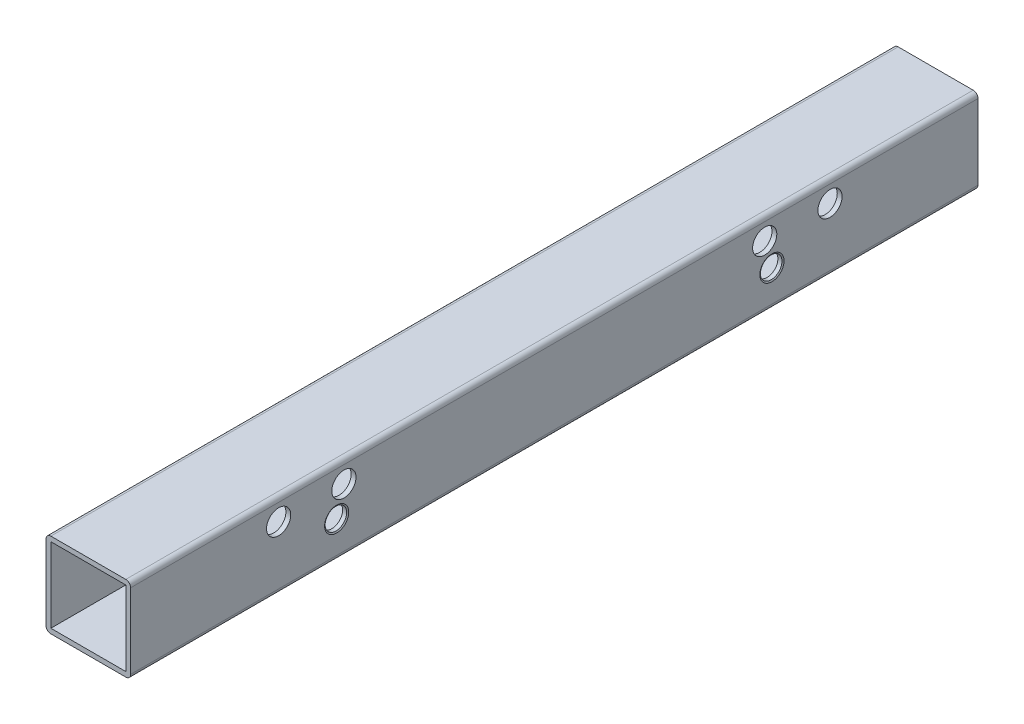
SolidWorks part; units mm, degrees
ref_plane "Plan1" through (0, 0, 0) normal (0, 0, 1) x (1, 0, 0)
ref_plane "Plan2" through (0, 0, 0) normal (0, 1, 0) x (1, 0, 0)
ref_plane "Plan3" through (0, 0, 0) normal (1, 0, 0) x (0, 0, -1)
sketch "Esquisse1" plane through (0, 0, 0) normal (0, 0, 1) x (1, 0, 0)
  line L0 (-15.5, 17.5) -> (15.5, 17.5)
  line L1 (-17.5, 15.5) -> (-17.5, -15.5)
  line L2 (15.5, -17.5) -> (-15.5, -17.5)
  line L3 (17.5, -15.5) -> (17.5, 15.5)
  line L4 (0, 20.6533) -> (0, -13.6915) construction
  line L5 (-16.7083, 0) -> (11.603, 0) construction
  arc A0 (17.5, 15.5) -> (15.5, 17.5) centre (15.5, 15.5) ccw
  arc A1 (17.5, -15.5) -> (15.5, -17.5) centre (15.5, -15.5) cw
  arc A2 (-15.5, -17.5) -> (-17.5, -15.5) centre (-15.5, -15.5) cw
  arc A3 (-15.5, 17.5) -> (-17.5, 15.5) centre (-15.5, 15.5) ccw
  point P12 (17.5, 17.5)
  point P19 (-17.5, 17.5)
  dimension "D2" = 2
  dimension "D1" = 35
extrude "Base-Extru.-Mince" add sketch "Esquisse1" along normal mid plane 420.4 thin
sketch "Esquisse3" plane through (0, 0, 0) normal (1, 0, 0) x (0, 0, -1)
  line L0 (-221.9166, -1.5) -> (222.6925, -1.5) construction
  line L1 (0, 50.0476) -> (0, -43.0642) construction
  line L9 (-210.2, 17.5) -> (210.2, 17.5) construction
  circle A0 centre (194.2, -1.5) radius 6
  circle A1 centre (-194.2, -1.5) radius 6
  dimension "D1" = 12
  dimension "D2" = 388.4
  dimension "D3" = 19
extrude "Enlèv. mat.-Extru.2" cut sketch "Esquisse3" against normal through all and the other way through all
sketch "Esquisse7" plane through (-17.5, 0, 0) normal (1, 0, 0) x (0, 0, -1)
  line L0 (0, 31.3884) -> (0, -31.3884) construction
  line L1 (-210.2, -17.5) -> (210.2, -17.5) construction
  circle A0 centre (90, -2.5) radius 4.45
  circle A1 centre (-90, -2.5) radius 4.45
  dimension "D1" = 180
  dimension "D2" = 15
  dimension "D3" = 8.9
extrude "Enlèv. mat.-Extru.4" cut sketch "Esquisse7" along normal up to next
sketch "Esquisse8" plane through (0, 0, 0) normal (1, 0, 0) x (0, 0, -1)
  line L0 (0, 33.5474) -> (0, -33.5474) construction
  line L1 (210.2, -15.5) -> (210.2, 15.5) construction
  line L2 (175.2, 17.5) -> (210.2, 17.5)
  line L3 (175.2, 17.5) -> (175.2, -17.5)
  line L4 (175.2, -17.5) -> (210.2, -17.5)
  line L5 (210.2, 17.5) -> (210.2, -17.5)
  line L6 (-210.2, 17.5) -> (-210.2, -17.5)
  line L7 (-175.2, -17.5) -> (-210.2, -17.5)
  line L8 (-175.2, 17.5) -> (-175.2, -17.5)
  line L9 (-175.2, 17.5) -> (-210.2, 17.5)
  dimension "D1" = 35
extrude "Enlèv. mat.-Extru.5" cut sketch "Esquisse8" against normal through all and the other way through all
sketch "Esquisse9" plane through (17.5, 0, 0) normal (1, 0, 0) x (0, 0, -1)
  line L0 (0, 26.9296) -> (0, -26.9296) construction
  line L1 (-175.2, 17.5) -> (175.2, 17.5) construction
  circle A0 centre (87, 8.54) radius 5
  circle A1 centre (114, 8.54) radius 5
  circle A2 centre (-114, 8.54) radius 5
  circle A3 centre (-87, 8.54) radius 5
  dimension "D1" = 27
  dimension "D2" = 174
  dimension "D4" = 10
  dimension "D3" = 8.96
extrude "Enlèv. mat.-Extru.6" cut sketch "Esquisse9" against normal up to surface (2 mm away)
sketch "Esquisse10" plane through (17.5, 0, 0) normal (1, 0, 0) x (0, 0, -1)
  circle A0 centre (87, 8.54) radius 3
  circle A1 centre (114, 8.54) radius 3
  circle A2 centre (-87, 8.54) radius 3
  circle A3 centre (-114, 8.54) radius 3
  circle A4 centre (-114, 8.54) radius 5 construction
  circle A5 centre (-87, 8.54) radius 5 construction
  circle A6 centre (87, 8.54) radius 5 construction
  circle A7 centre (114, 8.54) radius 5 construction
  dimension "D1" = 6
extrude "Enlèv. mat.-Extru.7" cut sketch "Esquisse10" against normal up to next
chamfer "Chanfrein1" distance 0.55 angle 30
sketch "Esquisse11" plane through (-17.5, 0, 0) normal (-1, 0, 0) x (0, 0, 1)
  circle A0 centre (87, 8.54) radius 3
  circle A1 centre (114, 8.54) radius 3
  circle A2 centre (-87, 8.54) radius 3
  circle A3 centre (-114, 8.54) radius 3
  circle A4 centre (-114, 8.54) radius 5 construction
  circle A5 centre (-87, 8.54) radius 5 construction
  circle A6 centre (87, 8.54) radius 5 construction
  circle A7 centre (114, 8.54) radius 5 construction
  circle A8 centre (114, 8.54) radius 3 construction
extrude "Enlèv. mat.-Extru.8" cut sketch "Esquisse11" against normal up to next
sketch "Esquisse12" plane through (17.5, 0, 0) normal (1, 0, 0) x (0, 0, -1)
  circle A0 centre (90, -2.5) radius 4.45
  circle A1 centre (-90, -2.5) radius 4.45
  circle A2 centre (-90, -2.5) radius 4.45 construction
  circle A3 centre (90, -2.5) radius 4.45 construction
extrude "Enlèv. mat.-Extru.9" cut sketch "Esquisse12" against normal up to next
chamfer "Chanfrein2" distance 0.55 angle 30
